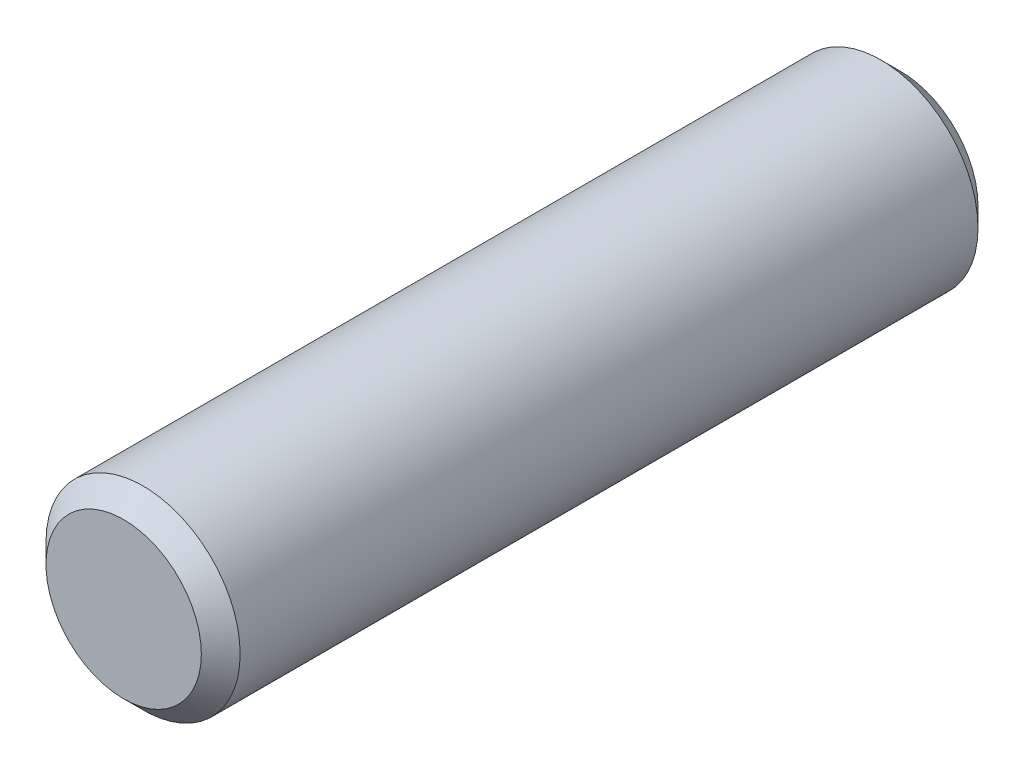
SolidWorks part; units mm, degrees
ref_plane "Front Plane" through (0, 0, 0) normal (0, 0, 1) x (1, 0, 0)
ref_plane "Top Plane" through (0, 0, 0) normal (0, 1, 0) x (1, 0, 0)
ref_plane "Right Plane" through (0, 0, 0) normal (1, 0, 0) x (0, 0, -1)
sketch "Sketch1" plane through (0, 0, 0) normal (0, 0, 1) x (1, 0, 0)
  circle A0 centre (0, 0) radius 3.175
  dimension "D1" = 6.35
extrude "Boss-Extrude1" add sketch "Sketch1" along normal blind 25.4
chamfer "Chamfer1" distance 0.635 angle 45 2 edges at (3.175, 0, 0) (3.175, 0, 25.4)
